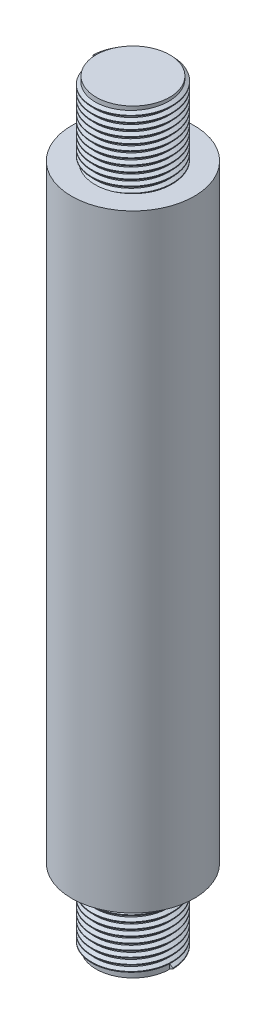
SolidWorks part; units mm, degrees
ref_plane "Front Plane" through (0, 0, 0) normal (0, 0, 1) x (1, 0, 0)
ref_plane "Top Plane" through (0, 0, 0) normal (0, 1, 0) x (1, 0, 0)
ref_plane "Right Plane" through (0, 0, 0) normal (1, 0, 0) x (0, 0, -1)
sketch "Outer Pipe" plane through (0, 0, 0) normal (0, 1, 0) x (1, 0, 0)
  circle A0 centre (0, 0) radius 15.875
  dimension "D1" = 31.75
extrude "BE - Outer Pipe" add sketch "Outer Pipe" along normal mid plane 157.48
sketch "End Part" plane through (0, 0, 0) normal (0, 1, 0) x (1, 0, 0)
  circle A0 centre (0, 0) radius 9.525
  dimension "D1" = 19.05
extrude "BE - End Part" add sketch "End Part" along normal mid plane 195.58
thread "Thread1" pitch 1.5875 start angle 0, offset 0, length 19.05, pitch 1.5875, diameter 19.05
ref_plane "Plane1" through (-9.525, 97.79, 0) normal (0, 0, 1) x (-1, 0, 0)
sketch "Thread Profile1" plane through (-9.525, 97.79, 0) normal (0, 0, 1) x (-1, 0, 0)
  line L0 (0, 0) -> (0, 1.5875) construction
  line L1 (0, 0) -> (0.8593, 0.4961)
  line L2 (0.8593, 0.4961) -> (0.8593, 0.6945)
  line L3 (0.8593, 0.6945) -> (0, 1.1906)
  line L4 (0.8593, 0.5953) -> (0, 0.5953) construction
  line L11 (0, 0) -> (0, 1.1906)
  point P2 (0, 0)
  dimension "Pitch" = 1.5875
  dimension "Profile_Angle" = 60
  dimension "Profile_Land" = 0.1984
  dimension "Profile_Height" = 0.8593
thread "Thread2" pitch 1.5875 start angle 0, offset 0, length 19.05, pitch 1.5875, diameter 19.05
ref_plane "Plane2" through (9.525, -97.79, 0) normal (0, 0, 1) x (1, 0, 0)
sketch "Thread Profile2" plane through (9.525, -97.79, 0) normal (0, 0, 1) x (1, 0, 0)
  line L0 (0, 0) -> (0, 1.5875) construction
  line L1 (0, 0) -> (0.8593, 0.4961)
  line L2 (0.8593, 0.4961) -> (0.8593, 0.6945)
  line L3 (0.8593, 0.6945) -> (0, 1.1906)
  line L4 (0.8593, 0.5953) -> (0, 0.5953) construction
  line L11 (0, 0) -> (0, 1.1906)
  point P2 (0, 0)
  dimension "Pitch" = 1.5875
  dimension "Profile_Angle" = 60
  dimension "Profile_Land" = 0.1984
  dimension "Profile_Height" = 0.8593
